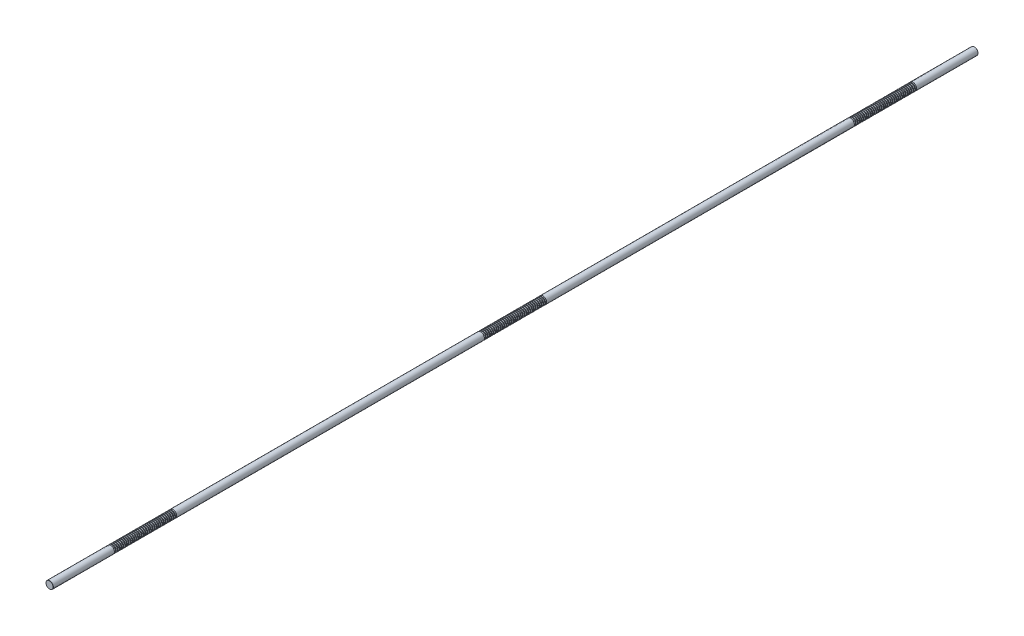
SolidWorks part; units mm, degrees
ref_plane "Front Plane" through (0, 0, 0) normal (0, 0, 1) x (1, 0, 0)
ref_plane "Top Plane" through (0, 0, 0) normal (0, 1, 0) x (1, 0, 0)
ref_plane "Right Plane" through (0, 0, 0) normal (1, 0, 0) x (0, 0, -1)
sketch "Sketch1" plane through (0, 0, 0) normal (0, 0, 1) x (1, 0, 0)
  circle A0 centre (0, 0) radius 6
  dimension "D1" = 12
extrude "Boss-Extrude1" add sketch "Sketch1" along normal mid plane 1500
chamfer "Chamfer1" distance 0.3 angle 45 2 edges at (6, 0, -750) (6, 0, 750)
sketch "Sketch2" plane through (0, 0, 0) normal (1, 0, 0) x (0, 0, -1)
  line L0 (650.2345, 6) -> (648.2655, 6)
  line L1 (749.7, 6) -> (-749.7, 6) construction
  line L2 (648.2655, 6) -> (648.7345, 4.25)
  line L3 (648.7345, 4.25) -> (649.7655, 4.25)
  line L4 (649.7655, 4.25) -> (650.2345, 6)
  line L5 (750, -5.7) -> (750, 5.7) construction
  point P4 (649.25, 6)
  point P7 (649.25, 4.25)
  point P8 (650, 5.125)
  point P9 (648.5, 5.125)
  dimension "D1" = 1.5
  dimension "D2" = 100
  dimension "D3" = 1.75
  dimension "D4" = 30
revolve "Cut-Revolve1" cut sketch "Sketch2" angle 360 about axis through (0, 0, 750) along (0, 0, -1)
pattern_linear "LPattern1" count 34 spacing 3 along (0, 0, 1) of "Cut-Revolve1"
pattern_linear "LPattern2" count 3 spacing 600 along (0, 0, 1) of "Cut-Revolve1", "LPattern1"
